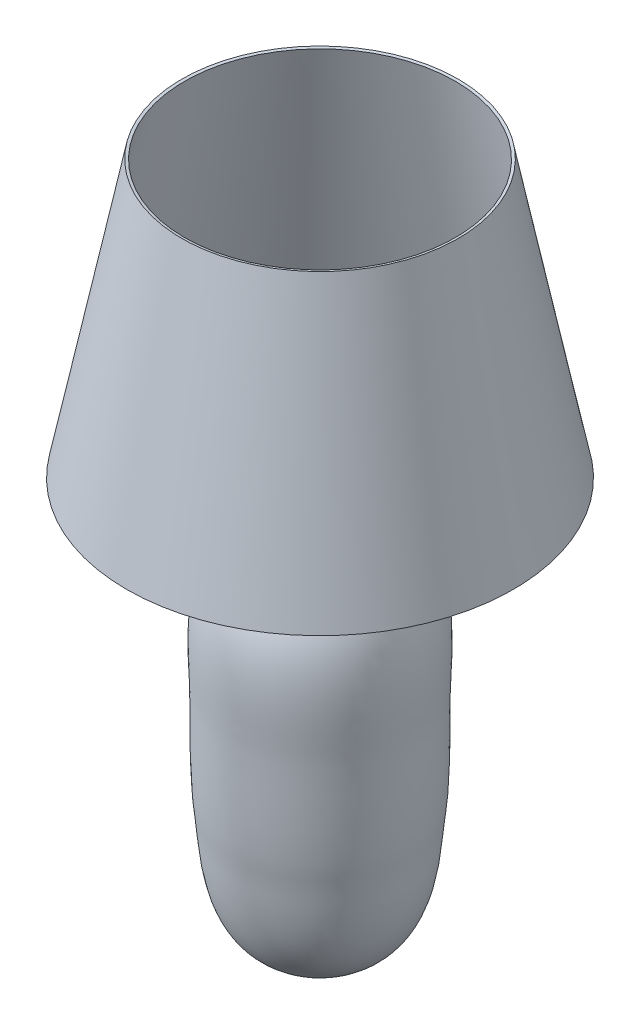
SolidWorks part; units mm, degrees
ref_plane "Płaszczyzna przednia" through (0, 0, 0) normal (0, 0, 1) x (1, 0, 0)
ref_plane "Płaszczyzna górna" through (0, 0, 0) normal (0, 1, 0) x (1, 0, 0)
ref_plane "Płaszczyzna prawa" through (0, 0, 0) normal (1, 0, 0) x (0, 0, -1)
sketch "Szkic1" plane through (0, 0, 0) normal (0, 0, 1) x (1, 0, 0)
  line L0 (269.7317, 539.4633) -> (1348.6583, 539.4633) construction
  line L1 (875.9434, 40.6211) -> (835.9434, 40.6211)
  line L2 (828.4434, 440.6211) -> (865.9434, 440.6211)
  line L3 (865.9434, 440.6211) -> (865.9434, 480.6211)
  line L4 (865.9434, 480.6211) -> (665.9434, 480.6211)
  line L5 (665.9434, 480.6211) -> (725.9434, 780.6211)
  line L6 (875.9434, 40.6211) -> (875.9434, 642.5313) construction
  spline S0 degree 3 poles (835.9434, 40.6211) (784.2932, 62.3198) (783.3751, 140.2558) (776.188, 192.8355) (775.8468, 249.312) (776.1497, 307.9519) (768.7866, 366.5481) (800.16, 422.2653) (826.8358, 435.9049) (828.9085, 434.9826) (828.4434, 440.6211) knots 0 0 0 0 0.244665 0.281494 0.444805 0.503002 0.805267 0.855039 0.962936 1 1 1 1
  point P13 (855.9434, 40.6211)
  dimension "D1" = 100
  dimension "D2" = 400
  dimension "D3" = 40
  dimension "D4" = 37.5
  dimension "D5" = 10
  dimension "D6" = 40
  dimension "D7" = 200
  dimension "D8" = 150
  dimension "D9" = 300
revolve "Obrót-cienka ścianka1" add sketch "Szkic1" angle 360 about L6
